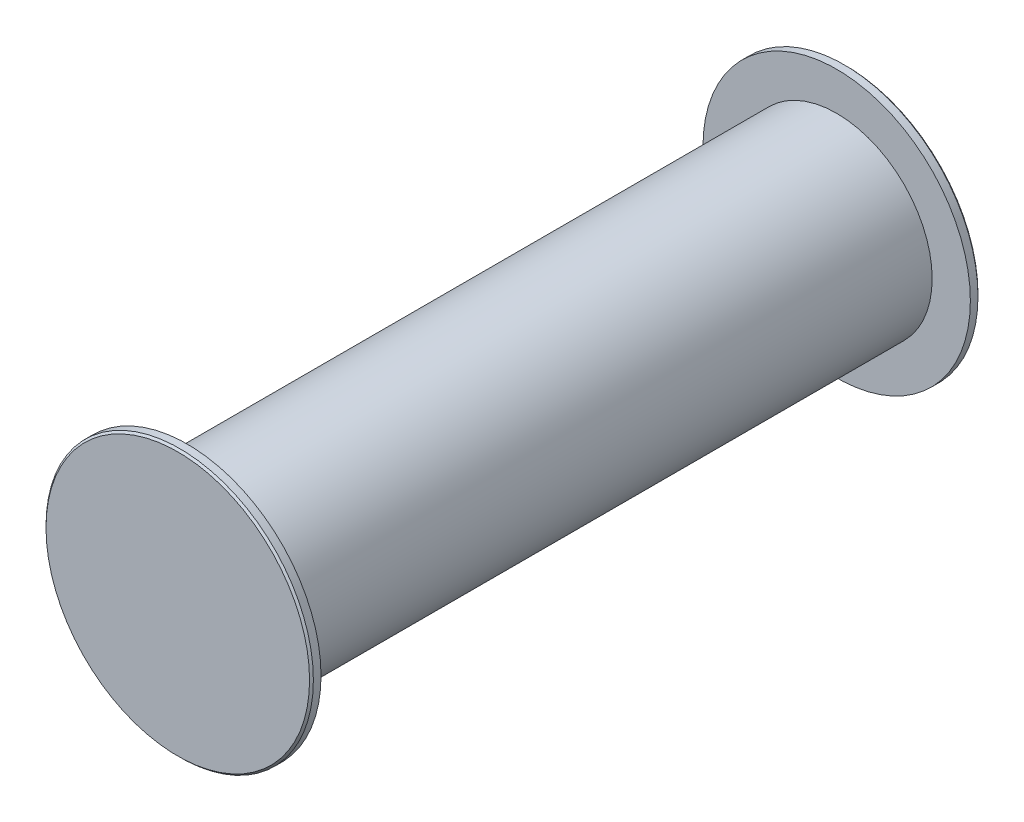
SolidWorks part; units mm, degrees
ref_plane "Plan1" through (0, 0, 0) normal (0, 0, 1) x (1, 0, 0)
ref_plane "Plan2" through (0, 0, 0) normal (0, 1, 0) x (1, 0, 0)
ref_plane "Plan3" through (0, 0, 0) normal (1, 0, 0) x (0, 0, -1)
sketch "Esquisse1" plane through (0, 0, 0) normal (0, 0, 1) x (1, 0, 0)
  circle A0 centre (0, 0) radius 5
  dimension "D1" = 10
extrude "Base-Extrusion" add sketch "Esquisse1" along normal blind 34
sketch "Esquisse2" plane through (0, 0, 34) normal (0, 0, 1) x (1, 0, 0)
  circle A0 centre (0, 0) radius 7
  dimension "D1" = 14
extrude "Boss.-Extru.1" add sketch "Esquisse2" along normal blind 0.5
chamfer "Chanfrein1" distance 0.1 angle 45
sketch "Esquisse3" plane through (0, 0, 0) normal (0, 0, -1) x (-1, 0, 0)
  circle A0 centre (0, 0) radius 7
  dimension "D1" = 14
extrude "Boss.-Extru.2" add sketch "Esquisse3" along normal blind 0.5
chamfer "Chanfrein2" distance 0.1 angle 45
